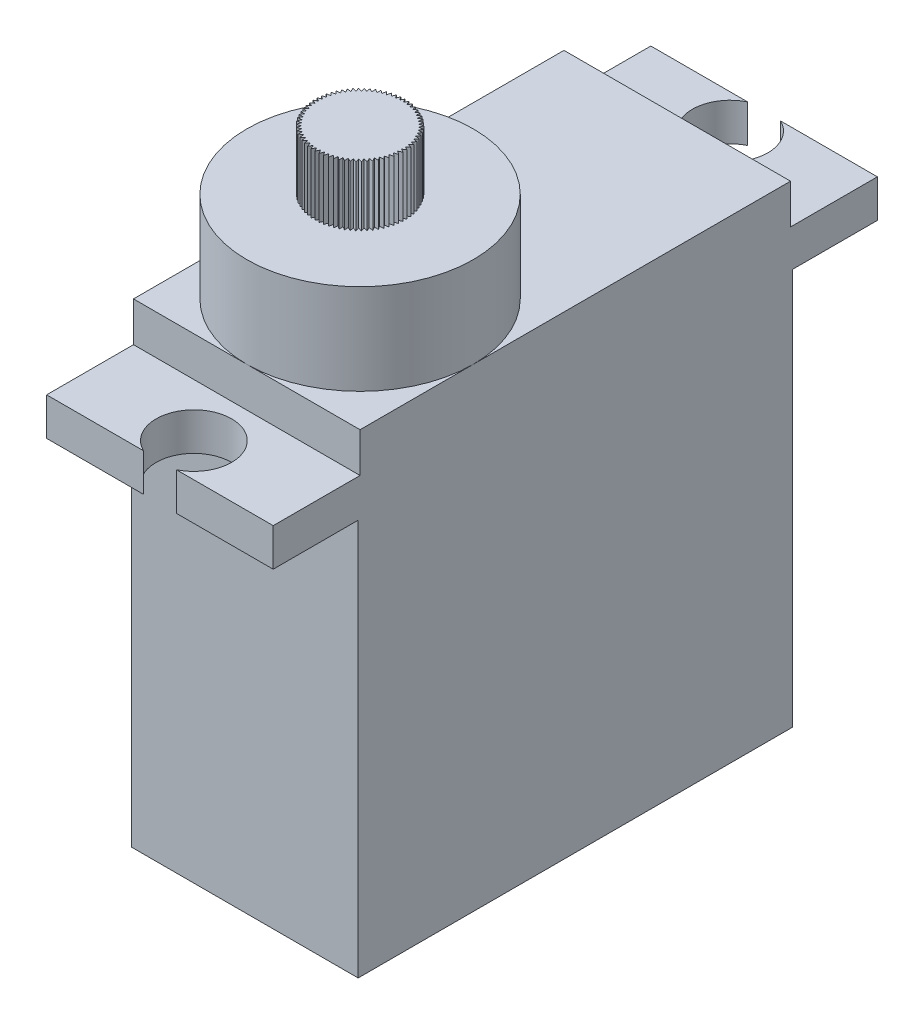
SolidWorks part; units mm, degrees
ref_plane "Front Plane" through (0, 0, 0) normal (0, 0, 1) x (1, 0, 0)
ref_plane "Top Plane" through (0, 0, 0) normal (0, 1, 0) x (1, 0, 0)
ref_plane "Right Plane" through (0, 0, 0) normal (1, 0, 0) x (0, 0, -1)
sketch "Sketch1" plane through (0, 0, 0) normal (0, 1, 0) x (1, 0, 0)
  line L0 (-6, 11.5) -> (6, -11.5) construction
  line L1 (-6, 11.5) -> (6, 11.5)
  line L2 (-6, 11.5) -> (-6, -11.5)
  line L3 (-6, -11.5) -> (6, -11.5)
  line L4 (6, 11.5) -> (6, -11.5)
  dimension "D1" = 12
  dimension "D2" = 23
extrude "Boss-Extrude1" add sketch "Sketch1" along normal blind 23
sketch "Sketch3" plane through (0, 0, 11.5) normal (0, 0, 1) x (1, 0, 0)
  line L0 (6, 23) -> (6, 0) construction
  line L1 (-6, 23) -> (6, 23)
  line L2 (-6, 23) -> (-6, 21)
  line L3 (-6, 21) -> (6, 21)
  line L4 (6, 23) -> (6, 21)
  dimension "D1" = 2
extrude "Boss-Extrude2" add sketch "Sketch3" along normal blind 4.5
sketch "Sketch4" plane through (0, 23, 0) normal (0, 1, 0) x (1, 0, 0)
  line L0 (0, 0) -> (0, -14.2) construction
  circle A0 centre (0, -14.2) radius 2
  dimension "D2" = 4
  dimension "D1" = 14.2
extrude "Cut-Extrude1" cut sketch "Sketch4" against normal through all
mirror "Mirror1" about plane through (0, 0, 0) normal (0, 0, 1) of "Cut-Extrude1", "Boss-Extrude2"
sketch "Sketch5" plane through (0, 23, 0) normal (0, 1, 0) x (1, 0, 0)
  line L0 (-6, 16) -> (-6, -16) construction
  line L1 (-6, 11.4) -> (6, 11.4)
  line L2 (-6, 11.4) -> (-6, -11.4)
  line L3 (-6, -11.4) -> (6, -11.4)
  line L4 (6, 11.4) -> (6, -11.4)
  line L5 (6, -16) -> (6, 16) construction
  line L6 (-6, 11.4) -> (6, -11.4) construction
  point P8 (0, 0)
  dimension "D1" = 22.8
extrude "Boss-Extrude3" add sketch "Sketch5" along normal blind 2.1
sketch "Sketch6" plane through (0, 25.1, 0) normal (0, 1, 0) x (1, 0, 0)
  line L0 (6, -11.4) -> (6, 11.4) construction
  line L1 (-6, -11.4) -> (6, -11.4) construction
  line L2 (-6, 11.4) -> (-6, -11.4) construction
  circle A0 centre (0, -5.4) radius 6
extrude "Boss-Extrude4" add sketch "Sketch6" along normal blind 4.8
sketch "Sketch7" plane through (0, 29.9, 0) normal (0, 1, 0) x (1, 0, 0)
  circle A0 centre (0, -5.4) radius 2.4
  dimension "D1" = 4.8
extrude "Boss-Extrude5" add sketch "Sketch7" along normal blind 3.175
sketch "Sketch8" plane through (0, 33.075, 0) normal (0, 1, 0) x (1, 0, 0)
  line L0 (-2.4, -5.5155) -> (-2.4, -5.2845) construction
  line L1 (-2.2, -5.4) -> (-2.5, -5.2268)
  line L2 (-2.5, -5.2268) -> (-2.5, -5.5732)
  line L3 (-2.5, -5.5732) -> (-2.2, -5.4)
  circle A0 centre (-2.4, -5.4) radius 0.1 construction
  circle A1 centre (0, -5.4) radius 2.4 construction
  dimension "D1" = 0.2
extrude "Cut-Extrude2" cut sketch "Sketch8" against normal up to surface (3.175 mm away)
pattern_circular "CirPattern1" count 70 over 360 about axis through (0, 0, 5.4) along (0, 1, 0) of "Cut-Extrude2"
